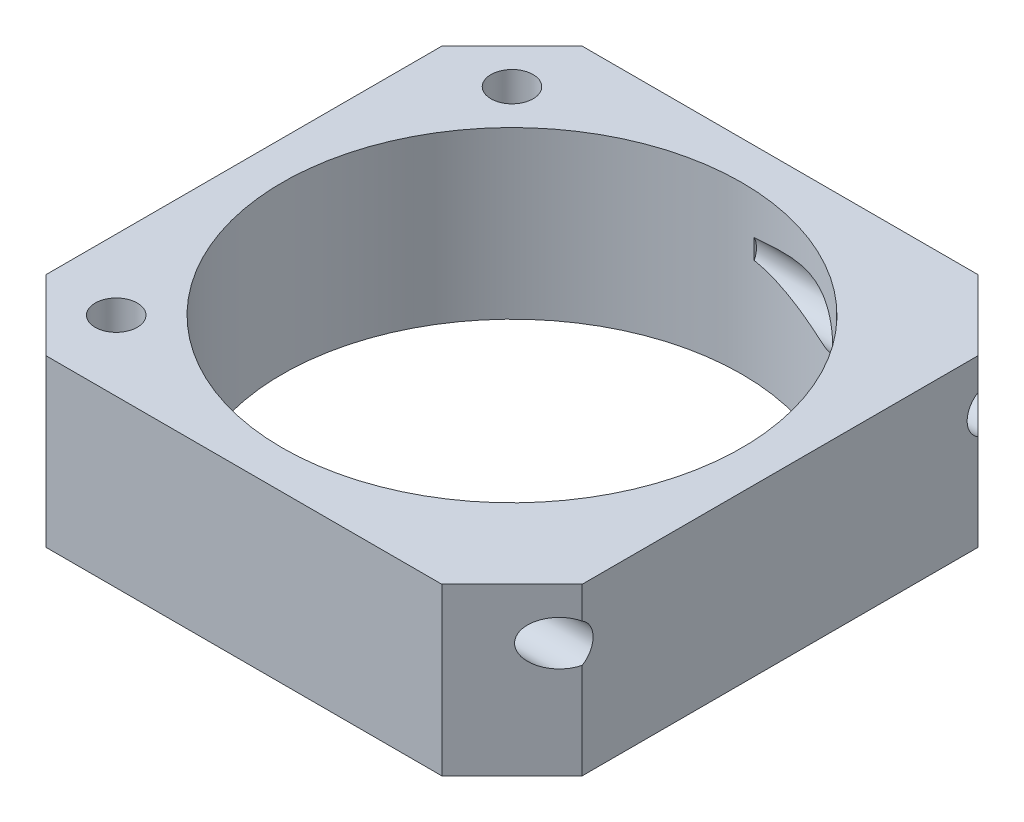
SolidWorks part; units mm, degrees
ref_plane "Front Plane" through (0, 0, 0) normal (0, 0, 1) x (1, 0, 0)
ref_plane "Top Plane" through (0, 0, 0) normal (0, 1, 0) x (1, 0, 0)
ref_plane "Right Plane" through (0, 0, 0) normal (1, 0, 0) x (0, 0, -1)
sketch "Sketch1" plane through (0, 0, 0) normal (0, 1, 0) x (1, 0, 0)
  line L1 (0, 0) -> (42, 0)
  line L2 (0, 0) -> (0, 42)
  line L3 (0, 42) -> (42, 42)
  line L4 (42, 0) -> (42, 42)
  circle A0 centre (5.5, 36.5) radius 1.65
  circle A1 centre (5.5, 5.5) radius 1.65
  circle A4 centre (21, 21) radius 18
  point P16 (21, 21)
  dimension "D3" = 5.5
  dimension "D5" = 3.3
  dimension "D7" = 36
  dimension "D6" = 5.5
  dimension "D9" = 3.3
  dimension "D1" = 42
  dimension "D2" = 42
  dimension "D4" = 5.5
  dimension "D8" = 5.5
extrude "Boss-Extrude1" add sketch "Sketch1" along normal blind 13
chamfer "Chamfer1" distance 5.5 angle 45 4 edges at (42, 6.5, 0) (42, 6.5, -42) (0, 6.5, 0) (0, 6.5, -42)
sketch "Sketch3" plane through (42, 0, 0) normal (1, 0, 0) x (0, 0, -1)
  line L0 (5.5, 0) -> (36.5, 0) construction
  line L1 (42, 13) -> (42, 0) construction
  circle A0 centre (37.4, 9) radius 1.75
  dimension "D1" = 9
  dimension "D2" = 3.5
  dimension "D3" = 4.6
extrude "Cut-Extrude2" cut sketch "Sketch3" against normal blind 20
sketch "Sketch4" plane through (42, 0, 0) normal (1, 0, 0) x (0, 0, -1)
  line L0 (5.5, 0) -> (36.5, 0) construction
  line L1 (0, 0) -> (0, 13) construction
  circle A0 centre (4.6, 9) radius 1.75
  dimension "D1" = 9
  dimension "D3" = 3.5
  dimension "D2" = 4.6
extrude "Cut-Extrude3" cut sketch "Sketch4" against normal blind 20
